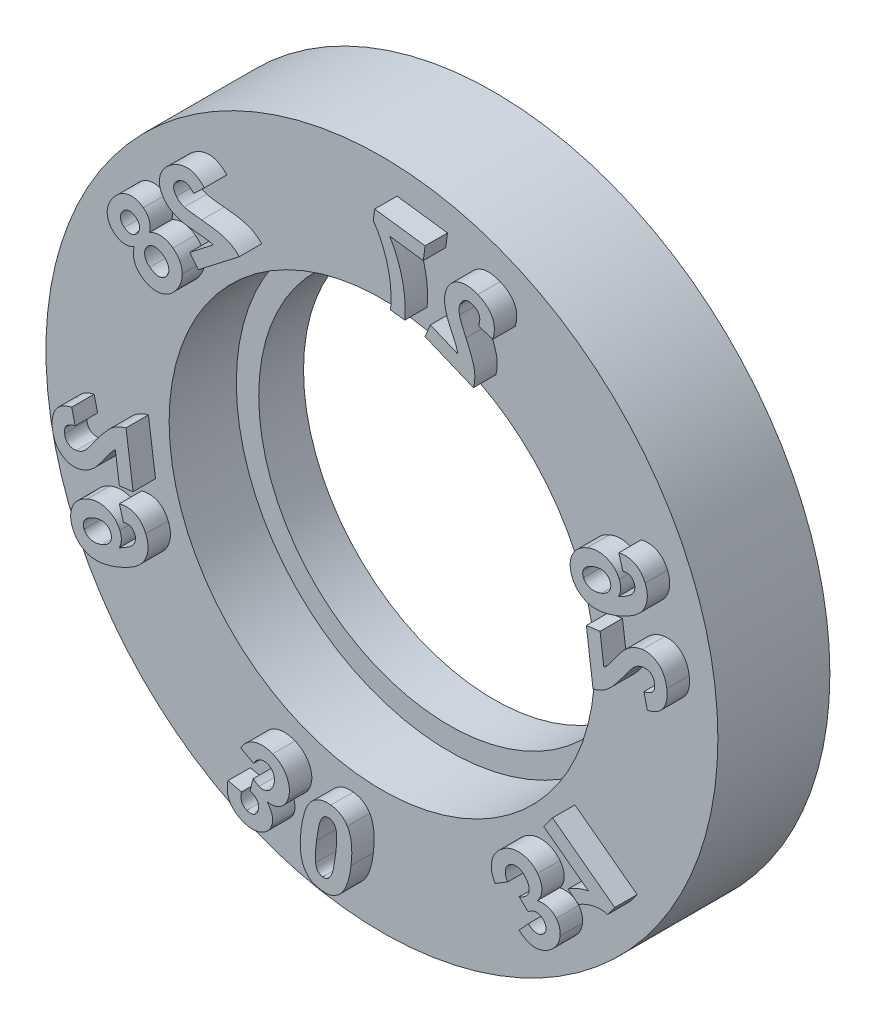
SolidWorks part; units mm, degrees
ref_plane "Front Plane" through (0, 0, 0) normal (0, 0, 1) x (1, 0, 0)
ref_plane "Top Plane" through (0, 0, 0) normal (0, 1, 0) x (1, 0, 0)
ref_plane "Right Plane" through (0, 0, 0) normal (1, 0, 0) x (0, 0, -1)
imported_body "Imported1"
other "DeleteFace3"
sketch "Sketch1" plane through (0, 0, 0) normal (0, 0, 1) x (1, 0, 0)
  circle A0 centre (0, 0) radius 10.4416 construction
  text T0 "26    27    28    29    30    31" font "Arial" height 3.5
extrude "Boss-Extrude1" add sketch "Sketch1" along normal blind 1
